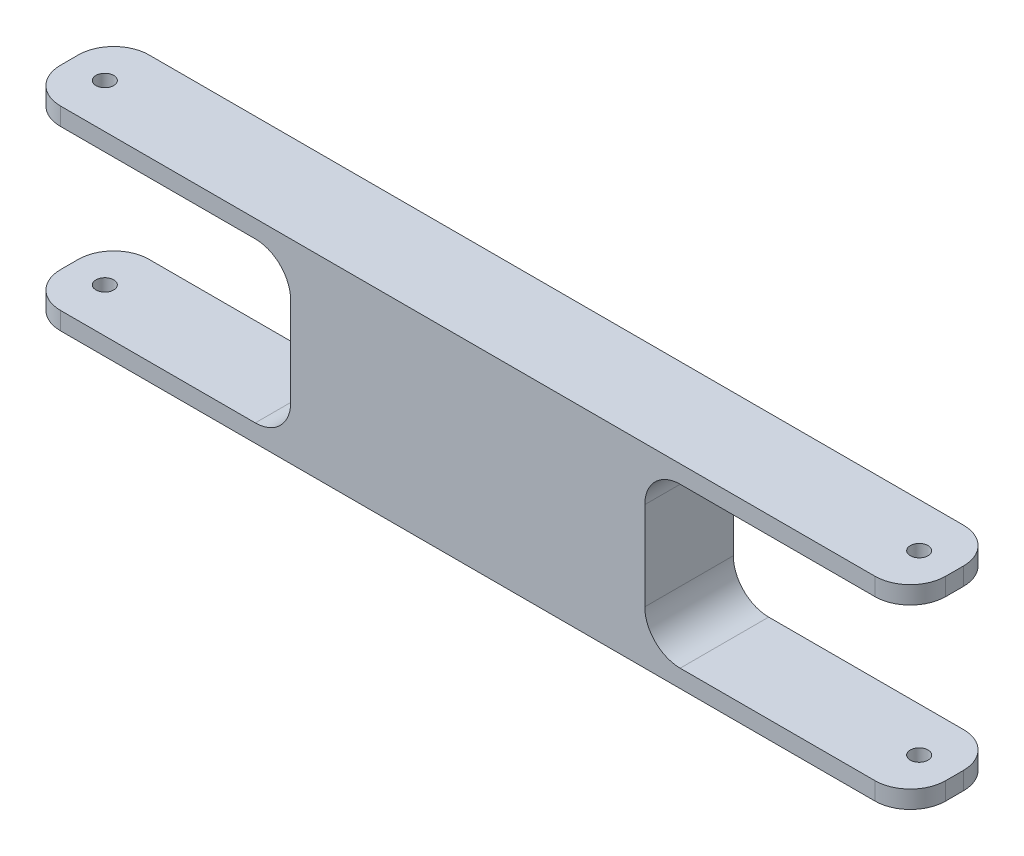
SolidWorks part; units mm, degrees
ref_plane "前视基准面" through (0, 0, 0) normal (0, 0, 1) x (1, 0, 0)
ref_plane "上视基准面" through (0, 0, 0) normal (0, 1, 0) x (1, 0, 0)
ref_plane "右视基准面" through (0, 0, 0) normal (1, 0, 0) x (0, 0, -1)
other "Configuration Table"
sketch "草图1" plane through (0, 0, 0) normal (0, 0, 1) x (1, 0, 0)
  line L1 (125, -27.5) -> (-125, -27.5)
  line L2 (125, -27.5) -> (125, 27.5)
  line L3 (125, 27.5) -> (-125, 27.5)
  line L4 (-125, -27.5) -> (-125, 27.5)
  line L5 (125, -27.5) -> (-125, 27.5) construction
  line L6 (125, 27.5) -> (-125, -27.5) construction
  point P0 (0, 0)
  dimension "D1" = 250
  dimension "D2" = 55
extrude "凸台-拉伸1" add sketch "草图1" along normal blind 25
sketch "草图2" plane through (0, 0, 25) normal (0, 0, 1) x (1, 0, 0)
  line L0 (125, -27.5) -> (125, 27.5) construction
  line L1 (125, 22.5) -> (50, 22.5)
  line L2 (125, 22.5) -> (125, -22.5)
  line L3 (125, -22.5) -> (50, -22.5)
  line L4 (50, 22.5) -> (50, -22.5)
  line L6 (-73.3018, 0) -> (76.0421, 0) construction
  line L7 (0, 43.63) -> (0, -40.4616) construction
  line L8 (-125, -22.5) -> (-50, -22.5)
  line L9 (-50, 22.5) -> (-50, -22.5)
  line L10 (-125, 22.5) -> (-50, 22.5)
  line L11 (-125, 22.5) -> (-125, -22.5)
  dimension "D1" = 45
  dimension "D2" = 75
  dimension "D3" = 22.5
extrude "切除-拉伸1" cut sketch "草图2" against normal blind 30
fillet "圆角1" radius 10 4 edges at (50, -22.5, 12.5) (-50, -22.5, 12.5) (50, 22.5, 12.5) (-50, 22.5, 12.5)
fillet "圆角2" radius 10 8 edges at (125, 25, 0) (125, 25, 25) (125, -25, 0) (125, -25, 25) (-125, 25, 25) (-125, 25, 0) (-125, -25, 0) (-125, -25, 25)
sketch "草图3" plane through (0, -27.5, 0) normal (0, -1, 0) x (1, 0, 0)
  line L2 (-115, 0) -> (115, 0) construction
  line L3 (0, 38.3122) -> (0, -12.1854) construction
  circle A0 centre (115, 12.5) radius 2.5
  circle A1 centre (-115, 12.5) radius 2.5
  dimension "D1" = 12.5
  dimension "D2" = 115
extrude "切除-拉伸3" cut sketch "草图3" against normal through all
